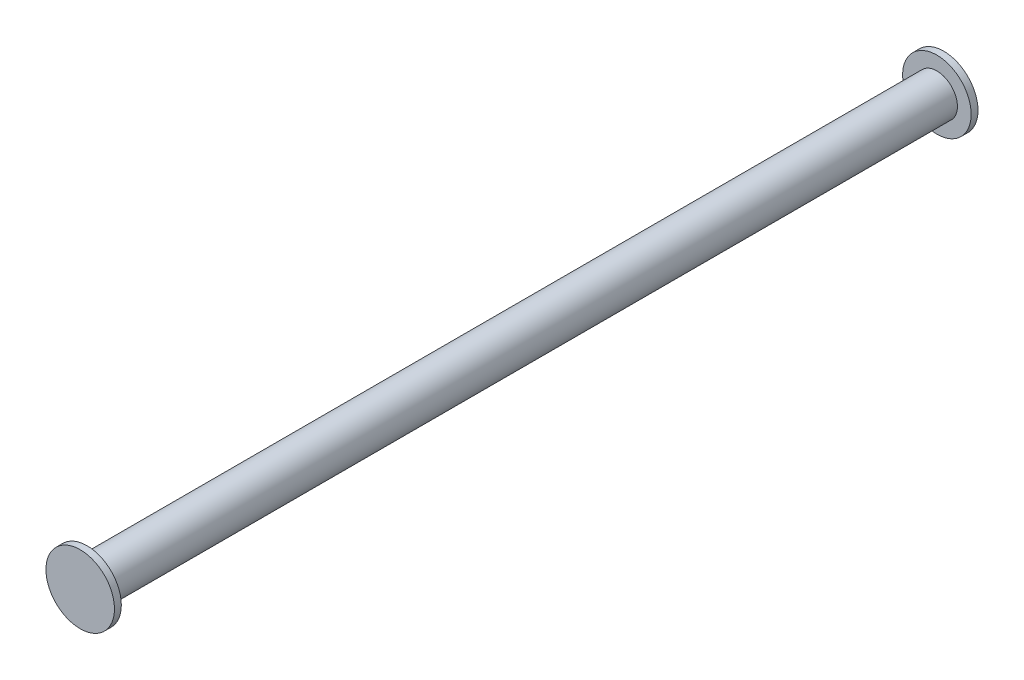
SolidWorks part; units mm, degrees
ref_plane "前视基准面" through (0, 0, 0) normal (0, 0, 1) x (1, 0, 0)
ref_plane "上视基准面" through (0, 0, 0) normal (0, 1, 0) x (1, 0, 0)
ref_plane "右视基准面" through (0, 0, 0) normal (1, 0, 0) x (0, 0, -1)
other "Configuration Table"
sketch "草图1" plane through (0, 0, 0) normal (0, 0, 1) x (1, 0, 0)
  circle A0 centre (0, 0) radius 10
  dimension "D1" = 20
extrude "Pin_With_End_Caps" add sketch "草图1" against normal mid plane 252
sketch "草图2" plane through (0, 0, 0) normal (0, 0, 1) x (1, 0, 0)
  circle A0 centre (0, 0) radius 12
  circle A1 centre (0, 0) radius 6
  dimension "D1" = 12
  dimension "D2" = 24
extrude "Shaft_D12_EndCaps_D20" cut sketch "草图2" against normal mid plane 248
